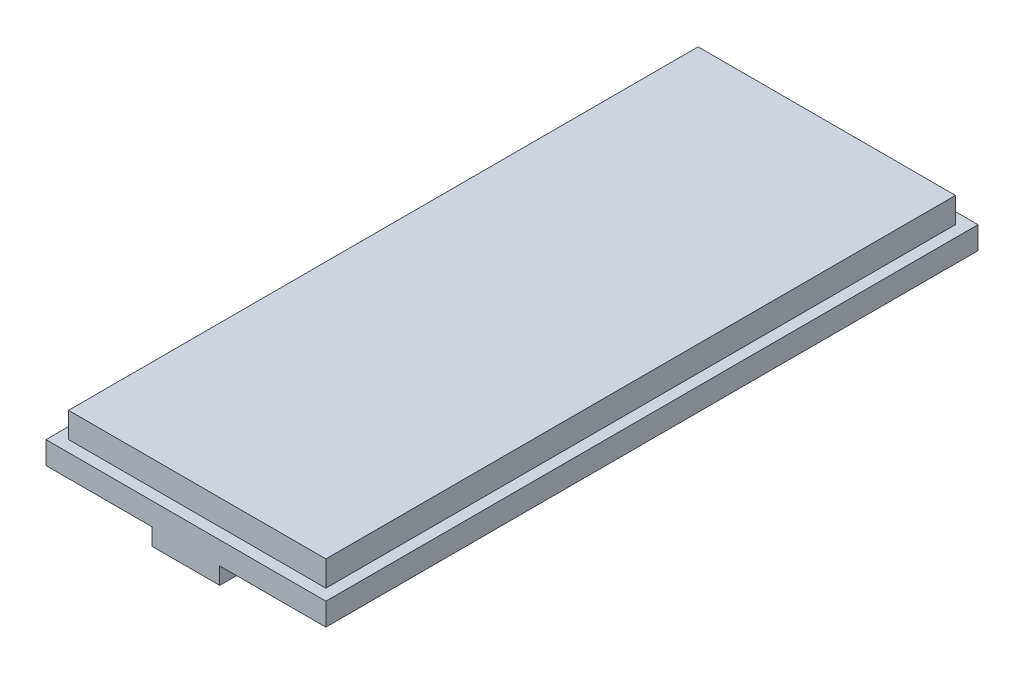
SolidWorks part; units mm, degrees
ref_plane "Plan de face" through (0, 0, 0) normal (0, 0, 1) x (1, 0, 0)
ref_plane "Plan de dessus" through (0, 0, 0) normal (0, 1, 0) x (1, 0, 0)
ref_plane "Plan de droite" through (0, 0, 0) normal (1, 0, 0) x (0, 0, -1)
sketch "Esquisse1" plane through (0, 0, 0) normal (0, 0, 1) x (1, 0, 0)
  line L0 (0, 0) -> (457, 0)
  line L1 (457, 0) -> (457, 45)
  line L26 (457, 45) -> (0, 45)
  line L27 (0, 45) -> (0, 0)
  dimension "D5" = 45
  dimension "D10" = 457
extrude "Extrusion1" add sketch "Esquisse1" along normal blind 1118
sketch "Esquisse3" plane through (0, 0, 0) normal (0, -1, 0) x (1, 0, 0)
  line L1 (-20, 1138) -> (477, 1138)
  line L2 (-20, 1138) -> (-20, -20)
  line L3 (-20, -20) -> (477, -20)
  line L4 (477, 1138) -> (477, -20)
  line L7 (457, 1118) -> (457, 0) construction
  line L8 (0, 1118) -> (0, 0) construction
  line L9 (0, 1118) -> (457, 1118) construction
  line L10 (0, 0) -> (457, 0) construction
  dimension "D1" = 20
  dimension "D2" = 20
  dimension "D3" = 20
  dimension "D4" = 20
extrude "Extrusion3" add sketch "Esquisse3" along normal blind 40
sketch "Esquisse4" plane through (0, -40, 0) normal (0, -1, 0) x (1, 0, 0)
  line L0 (477, 1138) -> (-20, 1138) construction
  line L1 (168.5, 1138) -> (288.5, 1138)
  line L2 (168.5, 1138) -> (168.5, -20)
  line L3 (168.5, -20) -> (288.5, -20)
  line L4 (288.5, 1138) -> (288.5, -20)
  line L5 (-20, -20) -> (477, -20) construction
  line L6 (-20, 1138) -> (-20, -20) construction
  dimension "D1" = 120
  dimension "D2" = 188.5
extrude "Extrusion4" add sketch "Esquisse4" along normal blind 30
